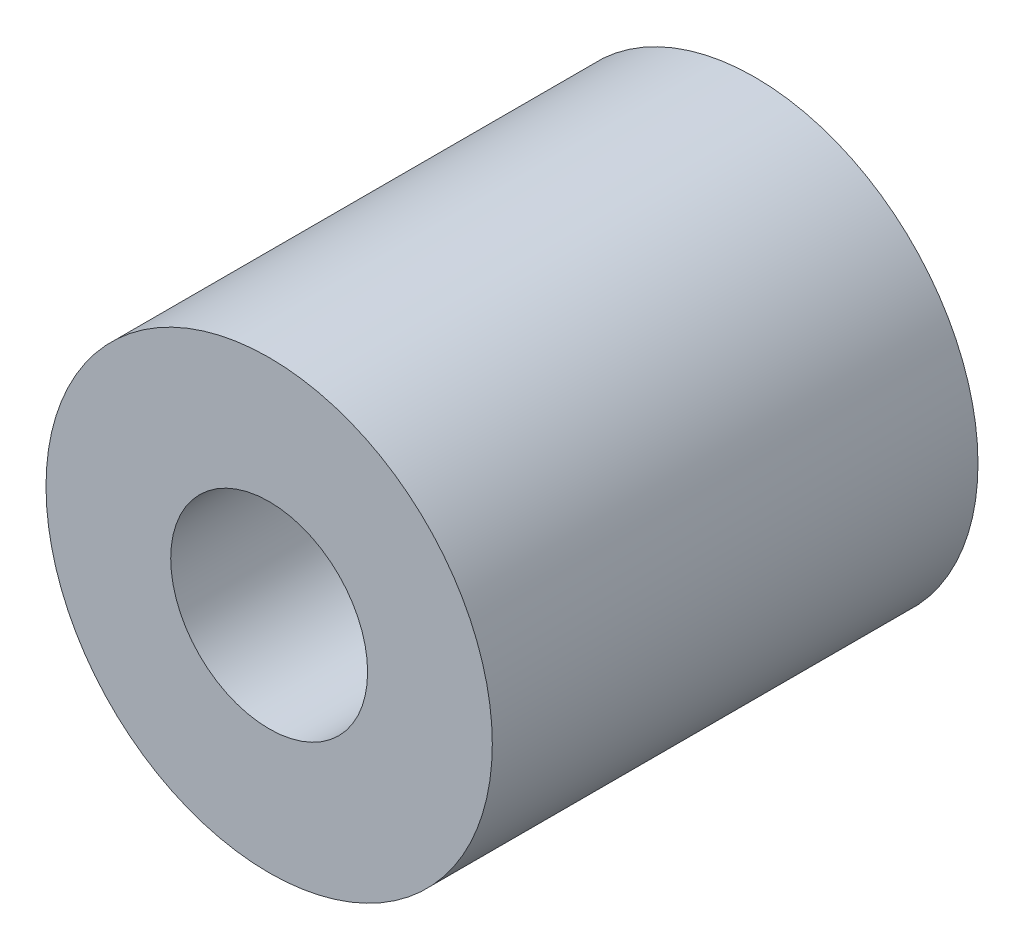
SolidWorks part; units mm, degrees
ref_plane "Plane1" through (0, 0, 0) normal (0, 0, 1) x (1, 0, 0)
ref_plane "Plane2" through (0, 0, 0) normal (0, 1, 0) x (1, 0, 0)
ref_plane "Plane3" through (0, 0, 0) normal (1, 0, 0) x (0, 0, -1)
sketch "Sketch1" plane through (0, 0, 0) normal (0, 0, 1) x (1, 0, 0)
  circle A0 centre (0, 0) radius 8.636
  dimension "D1" = 17.272
extrude "Base-Extrude" add sketch "Sketch1" along normal blind 18.796
sketch "Sketch2" plane through (0, 0, 18.796) normal (0, 0, 1) x (1, 0, 0)
  circle A0 centre (0, 0) radius 3.81
  dimension "D1" = 7.62
extrude "Cut-Extrude1" cut sketch "Sketch2" against normal blind 18.796
